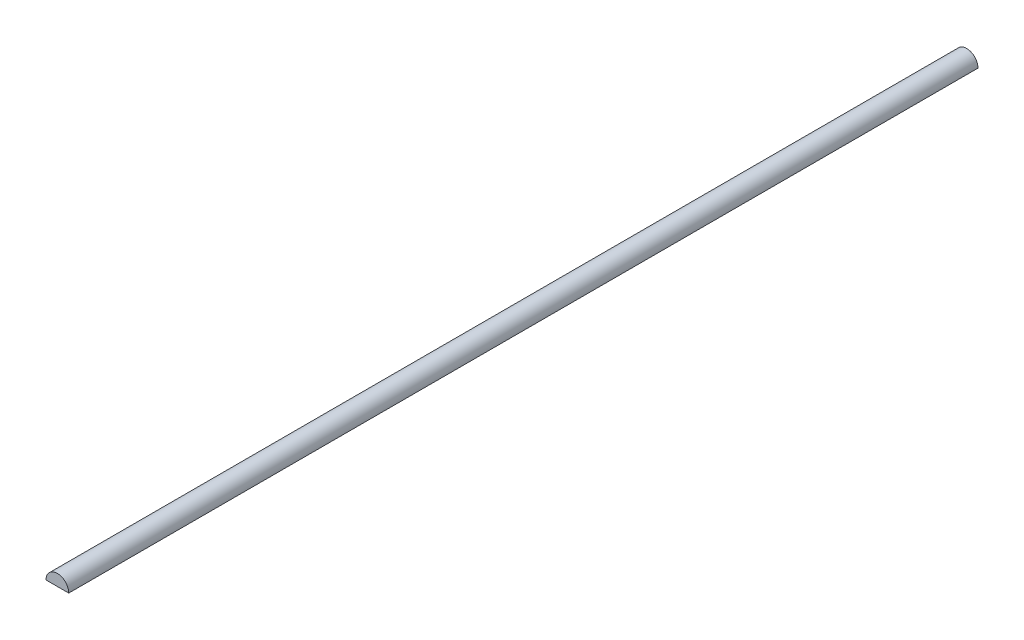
SolidWorks part; units mm, degrees
ref_plane "Front Plane" through (0, 0, 0) normal (0, 0, 1) x (1, 0, 0)
ref_plane "Top Plane" through (0, 0, 0) normal (0, 1, 0) x (1, 0, 0)
ref_plane "Right Plane" through (0, 0, 0) normal (1, 0, 0) x (0, 0, -1)
sketch "Sketch1" plane through (0, 0, 0) normal (0, 0, 1) x (1, 0, 0)
  line L0 (0, 0) -> (3.3417, 0) construction
  line L1 (0, 0) -> (0, 3.702) construction
  line L2 (-5, 0) -> (5, 0)
  arc A0 (5, 0) -> (-5, 0) centre (0, 0) ccw
extrude "Boss-Extrude1" add sketch "Sketch1" along normal blind 400
